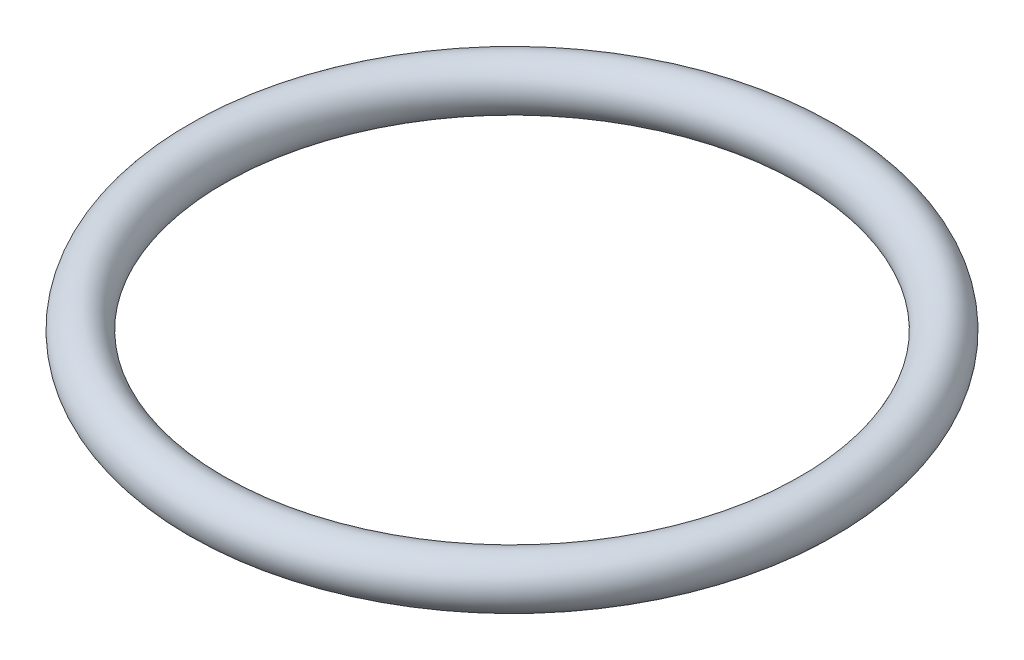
SolidWorks part; units mm, degrees
ref_plane "Front Plane" through (0, 0, 0) normal (0, 0, 1) x (1, 0, 0)
ref_plane "Top Plane" through (0, 0, 0) normal (0, 1, 0) x (1, 0, 0)
ref_plane "Right Plane" through (0, 0, 0) normal (1, 0, 0) x (0, 0, -1)
sketch "Sketch1" plane through (0, 0, 0) normal (0, 0, 1) x (1, 0, 0)
  line L0 (0, 0) -> (0, 1.2738) construction
  circle A0 centre (-14.45, 0) radius 1.15
revolve "Revolve1" add sketch "Sketch1" angle 360 about L0
